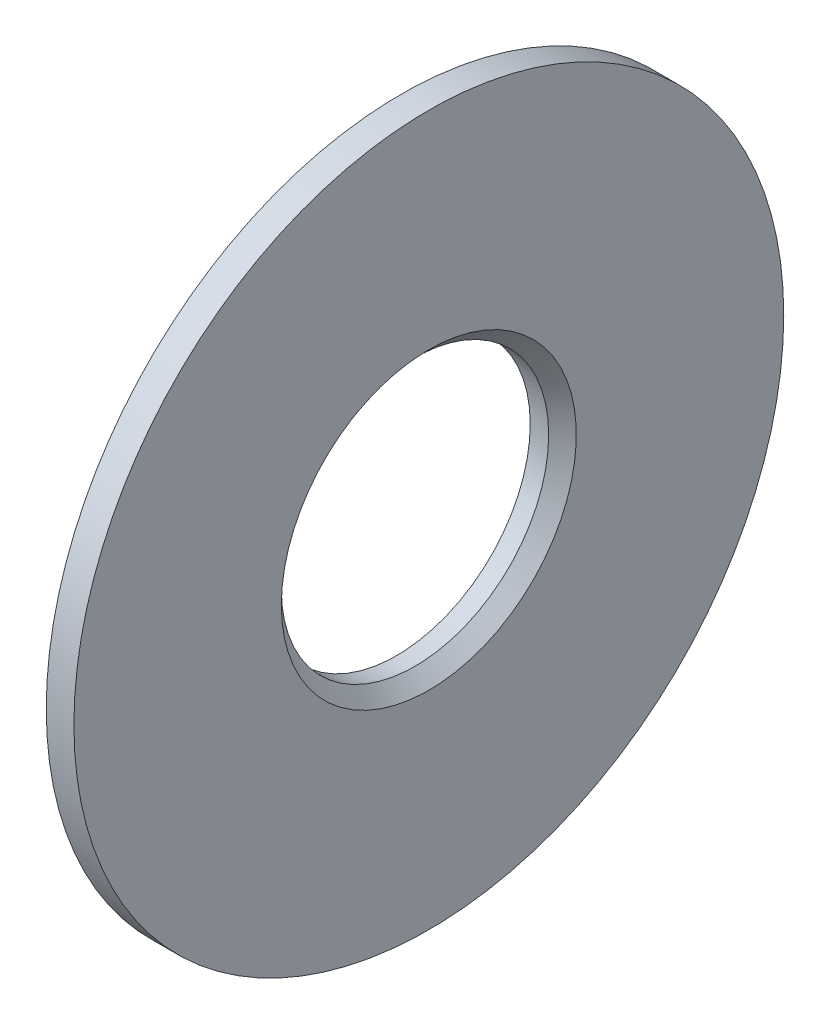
SolidWorks part; units mm, degrees
ref_plane "Face" through (0, 0, 0) normal (0, 0, 1) x (1, 0, 0)
ref_plane "Dessus" through (0, 0, 0) normal (0, 1, 0) x (1, 0, 0)
ref_plane "Droite" through (0, 0, 0) normal (1, 0, 0) x (0, 0, -1)
sketch "Esquisse1" plane through (0, 0, 0) normal (0, 0, 1) x (1, 0, 0)
  line L0 (0, 72.5) -> (10, 72.5)
  line L1 (17.5, 80) -> (17.5, 192.5)
  line L2 (17.5, 192.5) -> (2.5, 192.5)
  line L3 (2.5, 192.5) -> (2.5, 87.5)
  line L4 (2.5, 87.5) -> (0, 85)
  line L5 (0, 72.5) -> (0, 85)
  line L6 (0, 0) -> (80.5491, 0) construction
  line L7 (10, 72.5) -> (17.5, 80)
  point P1 (17.5, 72.5)
  dimension "D1" = 385
  dimension "D2" = 175
  dimension "D3" = 15
  dimension "D4" = 45
  dimension "D5" = 17.5
  dimension "D6" = 145
  dimension "D7" = 7.5
  dimension "D8" = 45
revolve "Révolution1" add sketch "Esquisse1" angle 360 about L6
